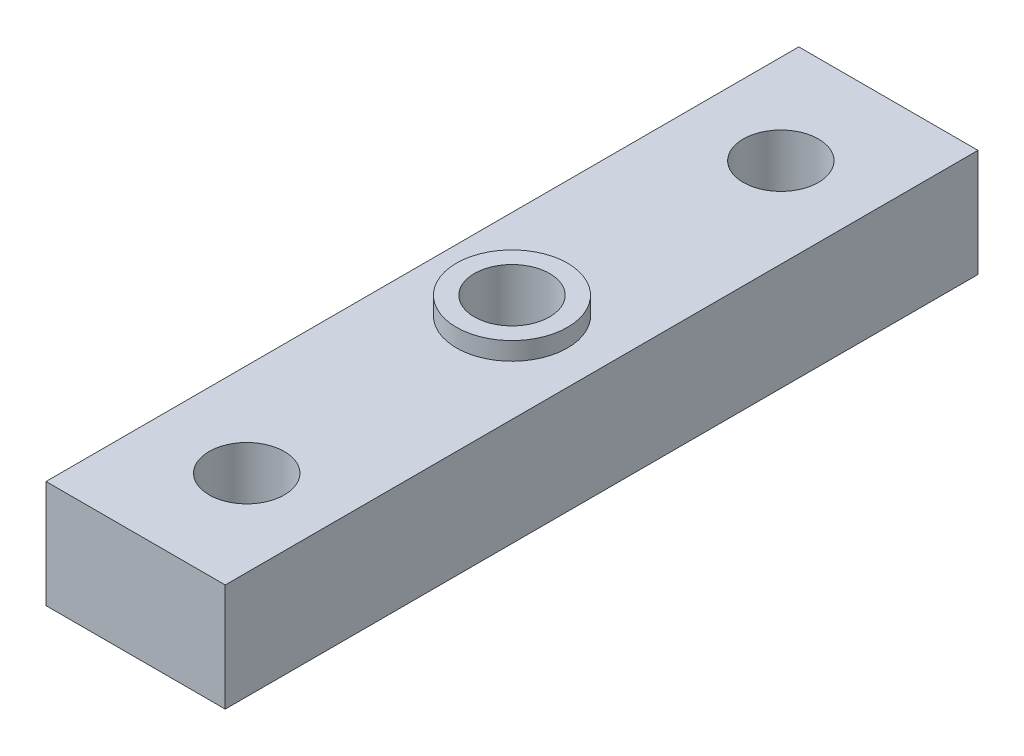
SolidWorks part; units mm, degrees
ref_plane "Спереди" through (0, 0, 0) normal (0, 0, 1) x (1, 0, 0)
ref_plane "Сверху" through (0, 0, 0) normal (0, 1, 0) x (1, 0, 0)
ref_plane "Справа" through (0, 0, 0) normal (1, 0, 0) x (0, 0, -1)
sketch "Эскиз1" plane through (0, 0, 0) normal (0, 1, 0) x (1, 0, 0)
  line L1 (0, 0) -> (10, 0)
  line L2 (0, 0) -> (0, 41.9987)
  line L3 (0, 41.9987) -> (10, 41.9987)
  line L4 (10, 0) -> (10, 41.9987)
  circle A0 centre (5.1999, 6) radius 2.1
  circle A1 centre (5, 20.9987) radius 2.1
  circle A2 centre (5, 35.9987) radius 2.1
  dimension "D1" = 4.2
  dimension "D2" = 15
  dimension "D3" = 15
  dimension "D4" = 6
  dimension "D5" = 5
  dimension "D6" = 5
  dimension "D7" = 6
  dimension "D8" = 41.9987
extrude "Бобышка-Вытянуть1" add sketch "Эскиз1" along normal blind 6
sketch "Эскиз2" plane through (0, 6, 0) normal (0, 1, 0) x (1, 0, 0)
  circle A0 centre (5, 20.9987) radius 2.1
  circle A1 centre (5, 20.9987) radius 3.1
  dimension "D1" = 4.2
  dimension "D2" = 1
extrude "Бобышка-Вытянуть2" add sketch "Эскиз2" along normal blind 1
